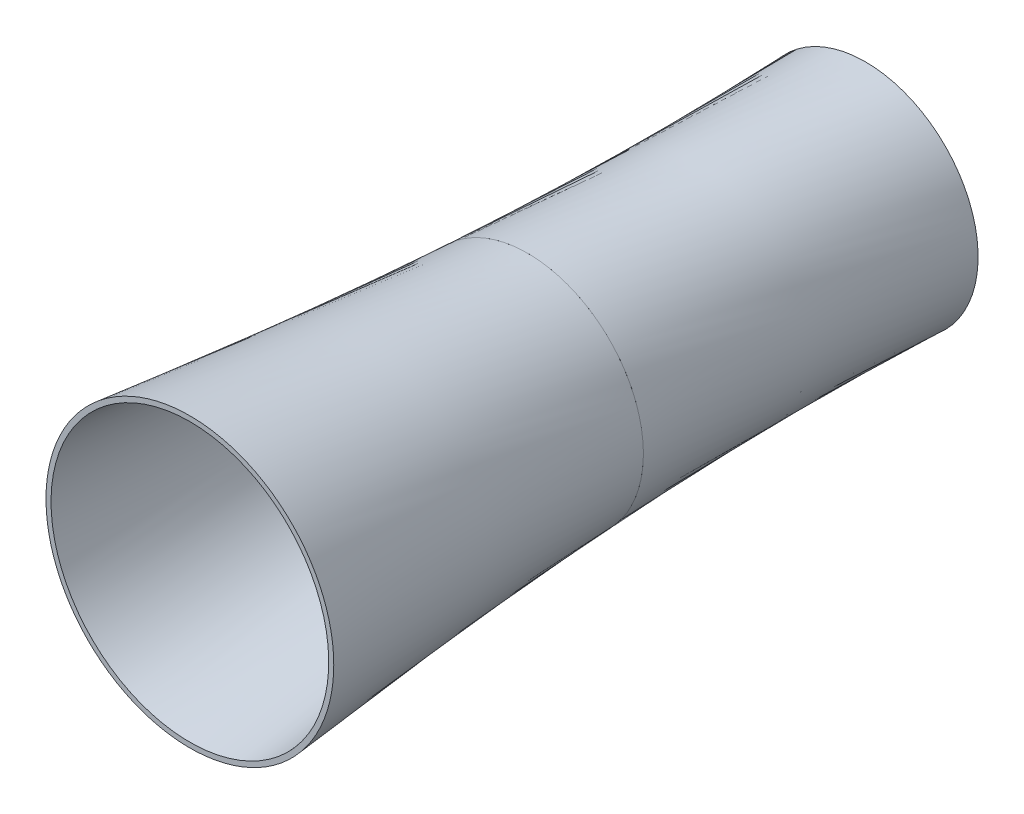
SolidWorks part; units mm, degrees
ref_plane "Front Plane" through (0, 0, 0) normal (0, 0, 1) x (1, 0, 0)
ref_plane "Top Plane" through (0, 0, 0) normal (0, 1, 0) x (1, 0, 0)
ref_plane "Right Plane" through (0, 0, 0) normal (1, 0, 0) x (0, 0, -1)
sketch "Sketch1" plane through (0, 0, 0) normal (0, 0, 1) x (1, 0, 0)
  circle A0 centre (0, 0) radius 45
  dimension "D1" = 90
ref_plane "Plane1" through (0, 0, 270) normal (0, 0, 1) x (1, 0, 0)
sketch "Sketch2" plane through (0, 0, 270) normal (0, 0, 1) x (1, 0, 0)
  circle A0 centre (0, 0) radius 57.5
  dimension "D1" = 115
loft "Loft1" add profiles "Sketch1", "Sketch2"
sketch "Sketch3" plane through (0, 0, 0) normal (0, 0, -1) x (-1, 0, 0)
  circle A0 centre (0, 0) radius 43
  circle A1 centre (0, 0) radius 45 construction
  dimension "D1" = 2
shell "Shell1" thickness 2
extrude "Cut-Extrude1" cut sketch "Sketch3" against normal up to surface (2 mm away)
ref_plane "Plane2" through (0, 0, 135) normal (0, 0, 1) x (1, 0, 0)
split "Split1" trim tools "Plane2" bodies to split 105 resulting bodies 107 108
